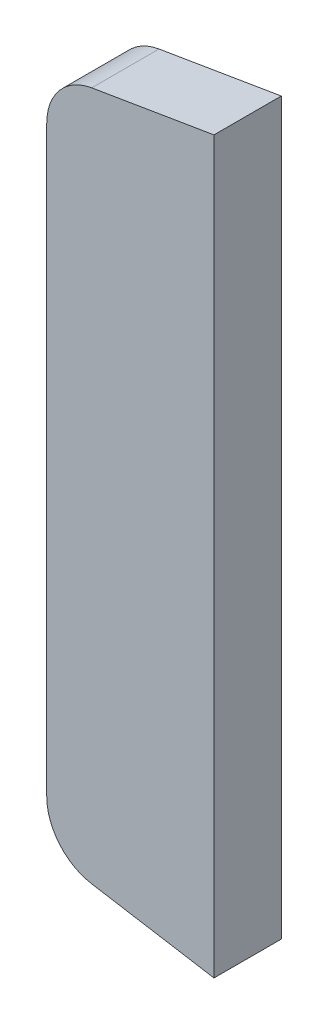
SolidWorks part; units mm, degrees
ref_plane "Front Plane" through (0, 0, 0) normal (0, 0, 1) x (1, 0, 0)
ref_plane "Top Plane" through (0, 0, 0) normal (0, 1, 0) x (1, 0, 0)
ref_plane "Right Plane" through (0, 0, 0) normal (1, 0, 0) x (0, 0, -1)
sketch "Sketch1" plane through (0, 0, 0) normal (0, 0, 1) x (1, 0, 0)
  line L0 (0, 54.2496) -> (0, -54.2496)
  line L4 (-18.1623, -51.2224) -> (0, -54.2496)
  line L5 (-24.847, 43.3312) -> (-24.847, -43.3312)
  line L6 (0, 54.2496) -> (-18.1623, 51.2224)
  line L7 (0, 0) -> (-72.8737, 0) construction
  arc A2 (-24.847, -43.3312) -> (-18.1623, -51.2224) centre (-16.847, -43.3312) ccw
  arc A3 (-18.1623, 51.2224) -> (-24.847, 43.3312) centre (-16.847, 43.3312) ccw
  dimension "D1" = 8
  dimension "D2" = 24.847
  dimension "D3" = 80.537
  dimension "D4" = 108.4993
extrude "Boss-Extrude1" add sketch "Sketch1" along normal mid plane 10
